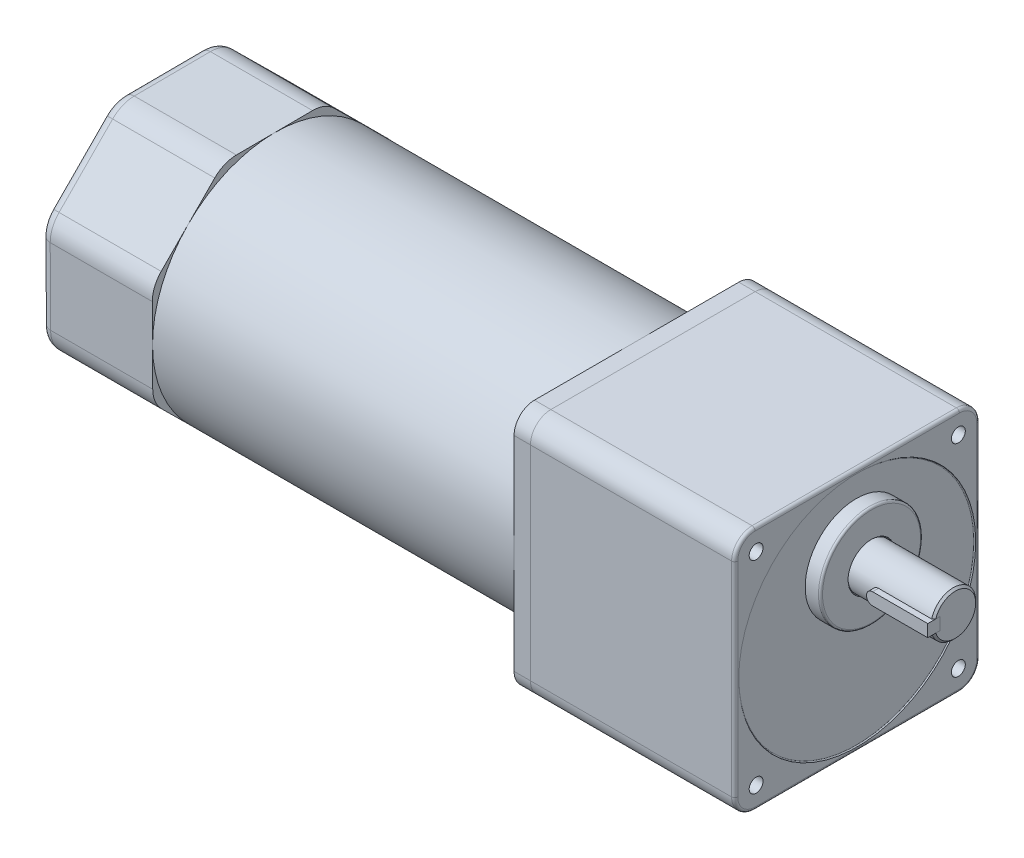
SolidWorks part; units mm, degrees
ref_plane "前视基准面" through (0, 0, 0) normal (0, 0, 1) x (1, 0, 0)
ref_plane "上视基准面" through (0, 0, 0) normal (0, 1, 0) x (1, 0, 0)
ref_plane "右视基准面" through (0, 0, 0) normal (1, 0, 0) x (0, 0, -1)
sketch "草图1" plane through (0, 0, 0) normal (1, 0, 0) x (0, 0, -1)
  line L1 (-50, -60) -> (50, -60)
  line L2 (-60, -50) -> (-60, 50)
  line L3 (-50, 60) -> (50, 60)
  line L4 (60, -50) -> (60, 50)
  line L5 (-60, -60) -> (60, 60) construction
  line L6 (-60, 60) -> (60, -60) construction
  arc A0 (-60, -50) -> (-50, -60) centre (-50, -50) ccw
  arc A1 (50, -60) -> (60, -50) centre (50, -50) ccw
  arc A2 (60, 50) -> (50, 60) centre (50, 50) ccw
  arc A3 (-60, 50) -> (-50, 60) centre (-50, 50) cw
  point P0 (0, 0)
  dimension "D1" = 10
extrude "凸台-拉伸1" add sketch "草图1" against normal blind 100
sketch "草图2" plane through (-100, 0, 0) normal (-1, 0, 0) x (0, 0, 1)
  circle A0 centre (0, 0) radius 60
extrude "凸台-拉伸2" add sketch "草图2" along normal blind 185 separate body
sketch "草图3" plane through (-285, 0, 0) normal (-1, 0, 0) x (0, 0, 1)
  line L1 (18.9549, 59.9011) -> (-18.3238, 60.0972)
  line L2 (-28.9533, 55.7597) -> (-55.452, 29.5383)
  line L3 (-59.9011, 18.9549) -> (-60.0972, -18.3238)
  line L4 (-55.7597, -28.9533) -> (-29.5383, -55.452)
  line L5 (-18.9549, -59.9011) -> (18.3238, -60.0972)
  line L6 (28.9533, -55.7597) -> (55.452, -29.5383)
  line L7 (59.9011, -18.9549) -> (60.0972, 18.3238)
  line L8 (55.7597, 28.9533) -> (29.5383, 55.452)
  arc A0 (-55.452, 29.5383) -> (-59.9011, 18.9549) centre (-44.9013, 18.876) ccw
  arc A1 (-60.0972, -18.3238) -> (-55.7597, -28.9533) centre (-45.0974, -18.4027) ccw
  arc A2 (-29.5383, -55.452) -> (-18.9549, -59.9011) centre (-18.876, -44.9013) ccw
  arc A3 (18.3238, -60.0972) -> (28.9533, -55.7597) centre (18.4027, -45.0974) ccw
  arc A4 (55.452, -29.5383) -> (59.9011, -18.9549) centre (44.9013, -18.876) ccw
  arc A5 (60.0972, 18.3238) -> (55.7597, 28.9533) centre (45.0974, 18.4027) ccw
  arc A6 (29.5383, 55.452) -> (18.9549, 59.9011) centre (18.876, 44.9013) ccw
  arc A7 (-28.9533, 55.7597) -> (-18.3238, 60.0972) centre (-18.4027, 45.0974) cw
  dimension "D1" = 15
extrude "凸台-拉伸6" add sketch "草图3" along normal blind 55
fillet "圆角3" radius 5 16 edges at (-340, 42.649, -42.2027) (-340, 58.9856, -24.0699) (-340, 59.9992, 0.3156) (-340, 58.7291, 24.6891) (-340, 42.2027, 42.649) (-340, 24.0699, 58.9856) (-340, -0.3156, 59.9992) (-340, -24.6891, 58.7291) (-340, -42.649, 42.2027) (-340, -58.9856, 24.0699) (-340, -59.9992, -0.3156) (-340, -58.7291, -24.6891) (-340, -42.2027, -42.649) (-340, -24.0699, -58.9856) (-340, 0.3156, -59.9992) (-340, 24.6891, -58.7291)
fillet "圆角4" radius 1.5 8 edges at (0, 0, 60) (0, 57.0711, 57.0711) (0, 60, 0) (0, 57.0711, -57.0711) (0, 0, -60) (0, -57.0711, -57.0711) (0, -60, 0) (0, -57.0711, 57.0711)
sketch "草图4" plane through (0, 0, 0) normal (1, 0, 0) x (0, 0, -1)
  point P0 (0, 0)
  point P7 (-49.5, 49.5)
  point P8 (-49.5, -49.5)
  point P9 (49.5, -49.5)
  point P10 (49.5, 49.5)
hole_wizard "M8 螺纹孔1" positions "3D草图1" profile "草图5" tap size "M8" standard "GB"
sketch3d "3D草图1"
  point P0 (0, 49.5, 49.5)
  point P3 (0, -49.5, 49.5)
  point P6 (0, -49.5, -49.5)
  point P9 (0, 49.5, -49.5)
sketch "草图5" plane through (0, 49.5, 49.5) normal (0, 1, 0) x (0, 0, -1)
  line L0 (0, 0) -> (0, 24.2929)
  line L1 (0, 24.2929) -> (3.4, 22.25)
  line L2 (3.4, 22.25) -> (3.4, 0)
  line L5 (3.4, 0) -> (0, 0)
  line L10 (0, 24.2929) -> (-3.4, 22.25) construction
  line L11 (0, -6.35) -> (0, 107.95) construction
  dimension "螺纹孔钻头直径" = 6.8
  dimension "螺纹孔钻头深度" = 22.25
  dimension "导头角度" = 118
sketch "草图6" plane through (-100, 0, 0) normal (-1, 0, 0) x (0, 0, 1)
  line L1 (-50, -60) -> (50, -60)
  line L2 (-60, -50) -> (-60, 50)
  line L3 (-50, 60) -> (50, 60)
  line L4 (60, -50) -> (60, 50)
  line L5 (-60, -60) -> (60, 60) construction
  line L6 (-60, 60) -> (60, -60) construction
  arc A0 (-60, -50) -> (-50, -60) centre (-50, -50) ccw
  arc A1 (50, -60) -> (60, -50) centre (50, -50) ccw
  arc A2 (60, 50) -> (50, 60) centre (50, 50) ccw
  arc A3 (-60, 50) -> (-50, 60) centre (-50, 50) cw
  point P0 (0, 0)
  dimension "D1" = 10
extrude "凸台-拉伸7" add sketch "草图6" along normal blind 8 separate body
sketch "草图7" plane through (0, 0, 0) normal (1, 0, 0) x (0, 0, -1)
  circle A0 centre (0, 0) radius 58
extrude "切除-拉伸1" cut sketch "草图7" against normal blind 0.5
fillet "圆角5" radius 0.5 1 edges at (-0.5, 0, -58)
sketch "草图8" plane through (-0.5, 0, 0) normal (1, 0, 0) x (0, 0, -1)
  circle A0 centre (0, 22) radius 25
extrude "凸台-拉伸8" add sketch "草图8" along normal blind 7.5
fillet "圆角6" radius 1 1 edges at (7, 22, -25)
sketch "草图9" plane through (7, 0, 0) normal (1, 0, 0) x (0, 0, -1)
  circle A0 centre (0, 22) radius 11.5
extrude "切除-拉伸2" cut sketch "草图9" against normal blind 0.5
fillet "圆角7" radius 0.5 1 edges at (6.5, 22, -11.5)
sketch "草图10" plane through (6.5, 0, 0) normal (1, 0, 0) x (0, 0, -1)
  circle A0 centre (0, 22) radius 11
extrude "凸台-拉伸9" add sketch "草图10" along normal blind 41.5
ref_plane "基准面1" through (0, 0, 11) normal (0, 0, 1) x (1, 0, 0)
chamfer "倒角1" distance 1 angle 45 1 edges at (48, 22, -11)
sketch "草图17" plane through (0, 0, 11) normal (0, 0, 1) x (1, 0, 0)
  line L1 (48, 12) -> (48, 32) construction
  line L2 (21, 25) -> (48, 25)
  line L3 (48, 25) -> (48, 19)
  line L4 (48, 19) -> (21, 19)
  arc A0 (21, 25) -> (21, 19) centre (21, 22) ccw
extrude "切除-拉伸3" cut sketch "草图17" against normal blind 3.5
sketch "草图18" plane through (0, 0, 7.5) normal (0, 0, 1) x (1, 0, 0)
  line L0 (21, 25) -> (48, 25)
  line L1 (48, 25) -> (48, 19)
  line L2 (48, 19) -> (21, 19)
  arc A0 (21, 25) -> (21, 19) centre (21, 22) ccw
extrude "凸台-拉伸10" add sketch "草图18" along normal blind 6 separate body
